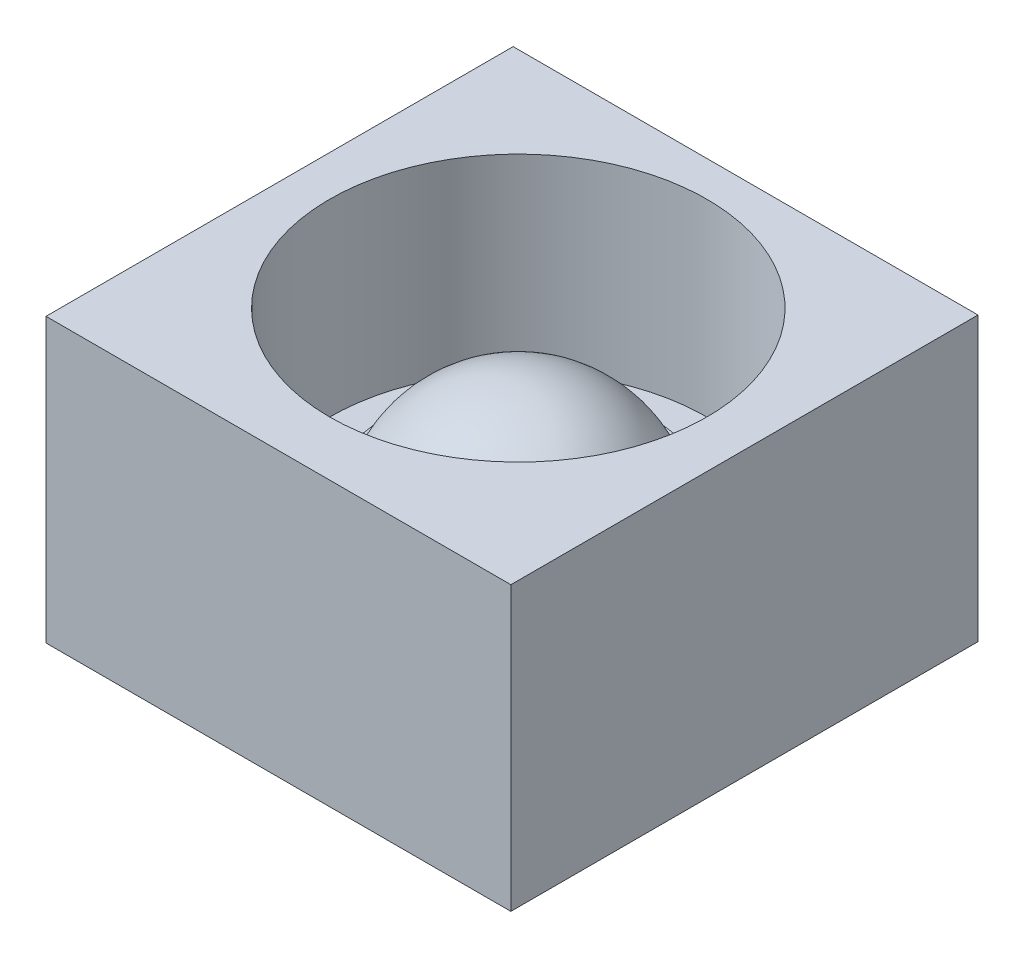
SolidWorks part; units mm, degrees
ref_plane "Front Plane" through (0, 0, 0) normal (0, 0, 1) x (1, 0, 0)
ref_plane "Top Plane" through (0, 0, 0) normal (0, 1, 0) x (1, 0, 0)
ref_plane "Right Plane" through (0, 0, 0) normal (1, 0, 0) x (0, 0, -1)
sketch "Sketch1" plane through (0, 0, 0) normal (0, 0, 1) x (1, 0, 0)
  line L0 (14.8295, 3) -> (14.8278, 0)
  line L1 (14.8278, 0) -> (19.8278, 0)
  line L2 (4.8278, 0) -> (4.8278, 13) construction
  line L4 (18.8278, 3) -> (17.8278, 3)
  line L6 (4.8278, 10.13) -> (4.8278, 13)
  line L8 (18.8278, 3) -> (19.8278, 0)
  line L12 (7.6978, 2.87) -> (14.8278, 2.87) construction
  line L13 (14.8278, 2.87) -> (14.8734, 2.87) construction
  line L14 (14.8734, 2.87) -> (14.8734, 2.87) construction
  line L15 (14.8734, 2.87) -> (14.8734, 2.87) construction
  line L16 (7.6978, 2.87) -> (7.6978, 9.7333) construction
  line L17 (4.8278, 0) -> (14.8278, 0) construction
  arc A0 (4.8278, 13) -> (17.8278, 3) centre (4.8278, -0.45) cw
  arc A1 (4.8278, 10.13) -> (14.8295, 3) centre (4.8278, -0.45) cw
  arc A2 (7.6978, 9.7333) -> (14.8734, 2.87) centre (4.8278, -0.45) cw construction
revolve "Revolve1" add sketch "Sketch1" angle 360 about L6
scale "Scale1" scale about centroid uniform scaling yes scale factor 1
other "Parting Line1"
other "Parting Surface1" parameters "D1"=11.1
sketch "Sketch2" plane through (0, 0, 0) normal (0, 1, 0) x (1, 0, 0)
  line L0 (4.8278, 0) -> (14.8295, 0) construction
  line L1 (4.8278, 0) -> (17.8278, 0) construction
  circle A0 centre (4.8278, 0) radius 20
  dimension "D1" = 40
other "Tooling Split1" parameters "D1"=10, "D2"=20, "D3"=3
move or copy body "Body-Move/Copy5" bodies to move or copy 108 copy no translate (0, -34.4321, 0)
move or copy body "Body-Move/Copy6" bodies to move or copy 103 copy no translate (0, -22.2088, 0)
delete or keep bodies "Body-Delete/Keep 2" type delete bodies bodies 113 114
sketch "Sketch3" plane through (0, 20, 0) normal (0, 1, 0) x (1, 0, 0)
  line L1 (-20.4382, 24.2789) -> (28.8497, 24.2789)
  line L2 (-20.4382, 24.2789) -> (-20.4382, -25.2525)
  line L3 (-20.4382, -25.2525) -> (28.8497, -25.2525)
  line L4 (28.8497, 24.2789) -> (28.8497, -25.2525)
extrude "Boss-Extrude2" add sketch "Sketch3" along normal blind 30 separate body
delete or keep bodies "Body-Delete/Keep 3" type delete bodies bodies 107
other "Cavity1"
other "Female<1>@Assem21"
